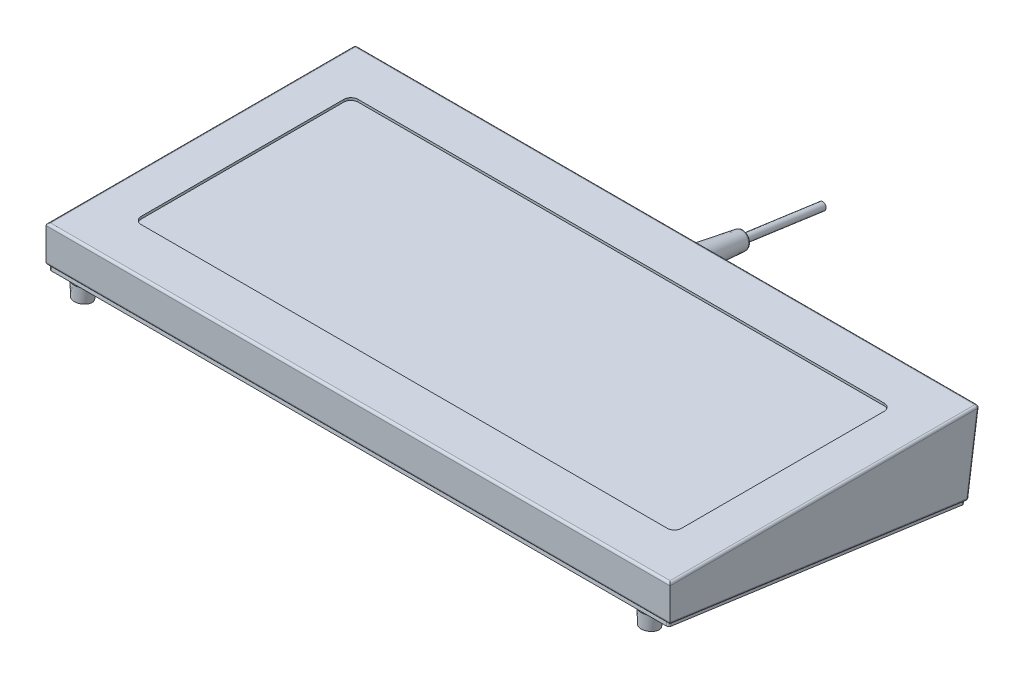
SolidWorks part; units mm, degrees
ref_plane "Front Plane" through (0, 0, 0) normal (0, 0, 1) x (1, 0, 0)
ref_plane "Top Plane" through (0, 0, 0) normal (0, 1, 0) x (1, 0, 0)
ref_plane "Right Plane" through (0, 0, 0) normal (1, 0, 0) x (0, 0, -1)
sketch "Sketch2" plane through (0, 0, 0) normal (1, 0, 0) x (0, 0, -1)
  line L0 (-7.2962, -51.9154) -> (0, 0)
  line L1 (0, 0) -> (-206.6855, 0)
  line L2 (-206.6855, 0) -> (-206.6608, -24.1046)
  line L4 (-7.2962, -51.9154) -> (-206.6608, -24.1046)
  dimension "D1" = 98
  dimension "D2" = 201.295
  dimension "D3" = 52.4256
  dimension "D4" = 24.1046
  dimension "D5" = 82
extrude "Enclosure Body" add sketch "Sketch2" along normal mid plane 416.56
fillet "Radii" radius 1.524 10 edges at (0, 0, 0) (208.28, 0, 103.3427) (0, 0, 206.6855) (-208.28, 0, 103.3427) (-208.28, -25.9577, 3.6481) (208.28, -25.9577, 3.6481) (-208.28, -38.01, 106.9785) (0, -24.1046, 206.6608) (208.28, -38.01, 106.9785) (0, -51.9154, 7.2962)
sketch "Sketch3" plane through (0, 0, 0) normal (0, 1, 0) x (1, 0, 0)
  line L1 (-175.5648, -31.0665) -> (175.5648, -31.0665)
  line L2 (-180.34, -35.8417) -> (-180.34, -171.0713)
  line L3 (-175.5648, -175.8465) -> (175.5648, -175.8465)
  line L4 (180.34, -35.8417) -> (180.34, -171.0713)
  line L6 (-206.756, -1.7532) -> (-206.756, -205.1599) construction
  arc A0 (-180.34, -171.0713) -> (-175.5648, -175.8465) centre (-175.5648, -171.0713) ccw
  arc A1 (175.5648, -175.8465) -> (180.34, -171.0713) centre (175.5648, -171.0713) ccw
  arc A2 (175.5648, -31.0665) -> (180.34, -35.8417) centre (175.5648, -35.8417) cw
  arc A3 (-175.5648, -31.0665) -> (-180.34, -35.8417) centre (-175.5648, -35.8417) ccw
  point P4 (0, -31.0665)
  point P5 (-180.34, -103.4565)
  point P10 (-180.34, -175.8465)
  point P13 (180.34, -175.8465)
  point P18 (-180.34, -31.0665)
  point P20 (-206.756, -103.4565)
  dimension "D4" = 4.7752
  dimension "D1" = 360.68
  dimension "D2" = 144.78
extrude "Keys Extrude" cut sketch "Sketch3" against normal blind 1.6002
sketch "Sketch4" plane through (0, -51.9228, 7.2431) normal (0, -0.9904, 0.1382) x (1, 0, 0)
  line L7 (-205.232, 200.517) -> (205.232, 200.517)
  line L8 (206.756, 198.993) -> (206.756, 2.5921)
  line L9 (205.232, 1.0681) -> (-205.232, 1.0681)
  line L10 (-206.756, 2.5921) -> (-206.756, 198.993)
  line L11 (-208.28, 1.5761) -> (-208.28, 201.5628) construction
  line L12 (208.28, 201.5628) -> (208.28, 1.5761) construction
  line L13 (-208.2652, 201.533) -> (208.2652, 201.533) construction
  line L14 (206.756, 0.0521) -> (-206.756, 0.0521) construction
  arc A4 (-206.756, 2.5921) -> (-205.232, 1.0681) centre (-205.232, 2.5921) ccw
  arc A5 (206.756, 2.5921) -> (205.232, 1.0681) centre (205.232, 2.5921) cw
  arc A6 (206.756, 198.993) -> (205.232, 200.517) centre (205.232, 198.993) ccw
  arc A7 (-205.232, 200.517) -> (-206.756, 198.993) centre (-205.232, 198.993) ccw
  dimension "D3" = 1.524
  dimension "D1" = 1.524
  dimension "D2" = 1.524
  dimension "D4" = 1.016
  dimension "D5" = 1.016
  dimension "D6" = 199.4489
  dimension "D7" = 413.512
extrude "Sub-panel Emboss" add sketch "Sketch4" along normal blind 2.286
sketch "Sketch11" plane through (0, -54.1869, 7.5589) normal (0, -0.9904, 0.1382) x (1, 0, 0)
  line L0 (-206.756, 198.993) -> (-206.756, 2.5921) construction
  circle A0 centre (0, 100.7926) radius 9.525
  point P9 (-206.756, 100.7926)
  dimension "D1" = 19.05
extrude "Gore Vent" add sketch "Sketch11" along normal blind 6.35
sketch "Sketch12" plane through (0, -54.1869, 7.5589) normal (0, -0.9904, 0.1382) x (1, 0, 0)
  line L0 (-189.23, 7.2825) -> (-189.23, 194.3027) construction
  line L1 (-189.23, 194.3027) -> (189.23, 194.3027) construction
  line L2 (189.23, 194.3027) -> (189.23, 7.2825) construction
  line L3 (189.23, 7.2825) -> (-189.23, 7.2825) construction
  line L4 (-206.756, 198.993) -> (-206.756, 2.5921) construction
  line L5 (205.232, 200.517) -> (-205.232, 200.517) construction
  circle A0 centre (-189.23, 194.3027) radius 6.985
  circle A1 centre (-189.23, 7.2825) radius 6.985
  circle A2 centre (189.23, 7.2825) radius 6.985
  circle A3 centre (189.23, 194.3027) radius 6.985
  point P8 (-189.23, 100.7926)
  point P11 (-206.756, 100.7926)
  point P12 (0, 194.3027)
  point P15 (0, 200.517)
  dimension "D1" = 13.97
  dimension "D2" = 187.0202
  dimension "D3" = 378.46
extrude "Rubber Feet" add sketch "Sketch12" along normal blind 9.398
draft "Draft1" type of draft neutral plane draft angle 8 faces to draft 4 parameters "D1"=8
sketch "Sketch13" plane through (0, 0, 0) normal (0, -0.1392, -0.9903) x (-1, 0, 0)
  line L0 (-206.756, -1.7532) -> (-206.756, -50.9032) construction
  circle A0 centre (0, -26.3282) radius 8.382
  point P5 (-206.756, -26.3282)
  dimension "D1" = 16.764
extrude "Cable Seal and Strain Relief" add sketch "Sketch13" along normal blind 53.975
draft "Draft2" type of draft neutral plane draft angle 3 faces to draft 1 parameters "D1"=3
fillet "Fillet1" radius 1.524 1 edges at (0, -28.0846, -50.5584)
sketch "Sketch14" plane through (0, -7.5119, -53.4497) normal (0, -0.1392, -0.9903) x (-1, 0, 0)
  circle A0 centre (0, -26.3282) radius 2.4765
  dimension "D1" = 4.953
extrude "Cable Depiction" add sketch "Sketch14" along normal blind 53.975
